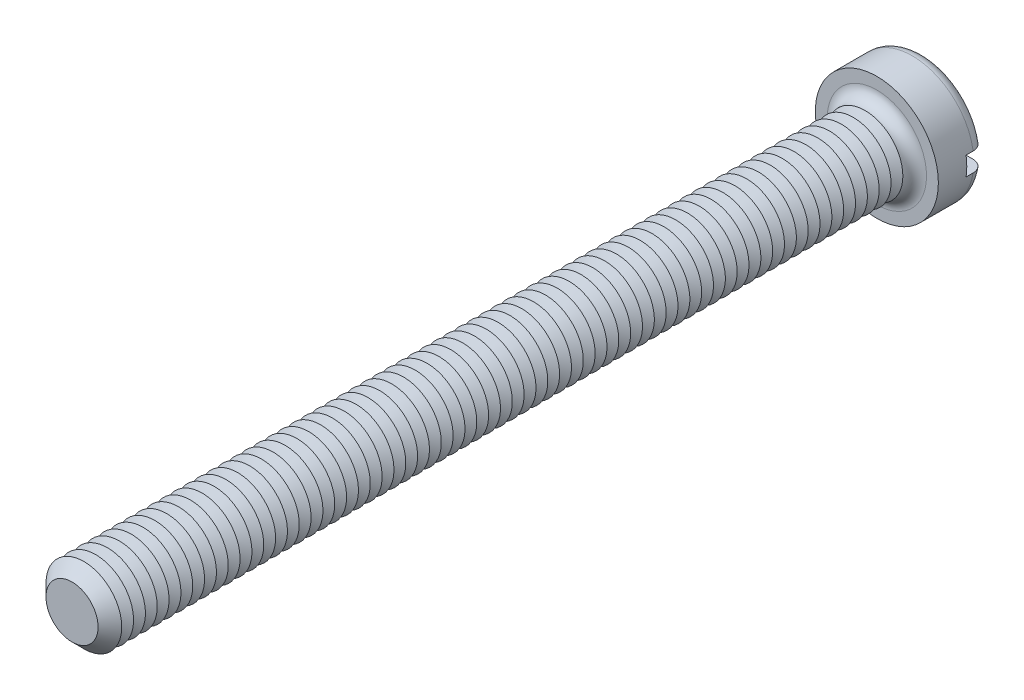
SolidWorks part; units mm, degrees
ref_plane "Front Plane" through (0, 0, 0) normal (0, 0, 1) x (1, 0, 0)
ref_plane "Top Plane" through (0, 0, 0) normal (0, 1, 0) x (1, 0, 0)
ref_plane "Right Plane" through (0, 0, 0) normal (1, 0, 0) x (0, 0, -1)
sketch "Sketch3" plane through (0, 0, 0) normal (0, 0, 1) x (1, 0, 0)
  circle A0 centre (0, 0) radius 6.5
  dimension "D1" = 13
extrude "Boss-Extrude2" add sketch "Sketch3" against normal blind 5
sketch "Sketch4" plane through (0, 0, 0) normal (0, 0, 1) x (1, 0, 0)
  circle A0 centre (0, 0) radius 4
  dimension "D1" = 8
extrude "Boss-Extrude3" add sketch "Sketch4" along normal blind 85
fillet "Fillet1" radius 1.25 2 edges at (6.5, 0, -5) (4, 0, 0)
chamfer "Chamfer1" distance 1.25 angle 45 1 edges at (4, 0, 85)
sketch "Sketch5" plane through (0, 0, 0) normal (1, 0, 0) x (0, 0, -1)
  line L0 (1.6944, 0) -> (-7.6738, 0) construction
sketch "Sketch6" plane through (0, 0, 0) normal (1, 0, 0) x (0, 0, -1)
  line L0 (-1.25, 4) -> (-1.875, 2.9175)
  line L1 (-1.875, 2.9175) -> (-2.5, 4)
  line L2 (-1.25, 4) -> (-83.75, 4) construction
  line L3 (-2.5, 4) -> (-1.25, 4)
  dimension "D1" = 1.25
revolve "Cut-Revolve1" cut sketch "Sketch6" angle 360 about L0
pattern_linear "LPattern1" count 66 spacing 1.25 along (0, 0, 1) of "Cut-Revolve1"
sketch "Sketch8" plane through (0, 0, -5) normal (0, 0, -1) x (-1, 0, 0)
  line L1 (6.5, -1) -> (-6.5, -1)
  line L2 (6.5, -1) -> (6.5, 1)
  line L3 (6.5, 1) -> (-6.5, 1)
  line L4 (-6.5, -1) -> (-6.5, 1)
  line L5 (6.5, -1) -> (-6.5, 1) construction
  line L6 (6.5, 1) -> (-6.5, -1) construction
  point P0 (0, 0)
  dimension "D1" = 13
  dimension "D2" = 2
extrude "Cut-Extrude1" cut sketch "Sketch8" against normal blind 2
